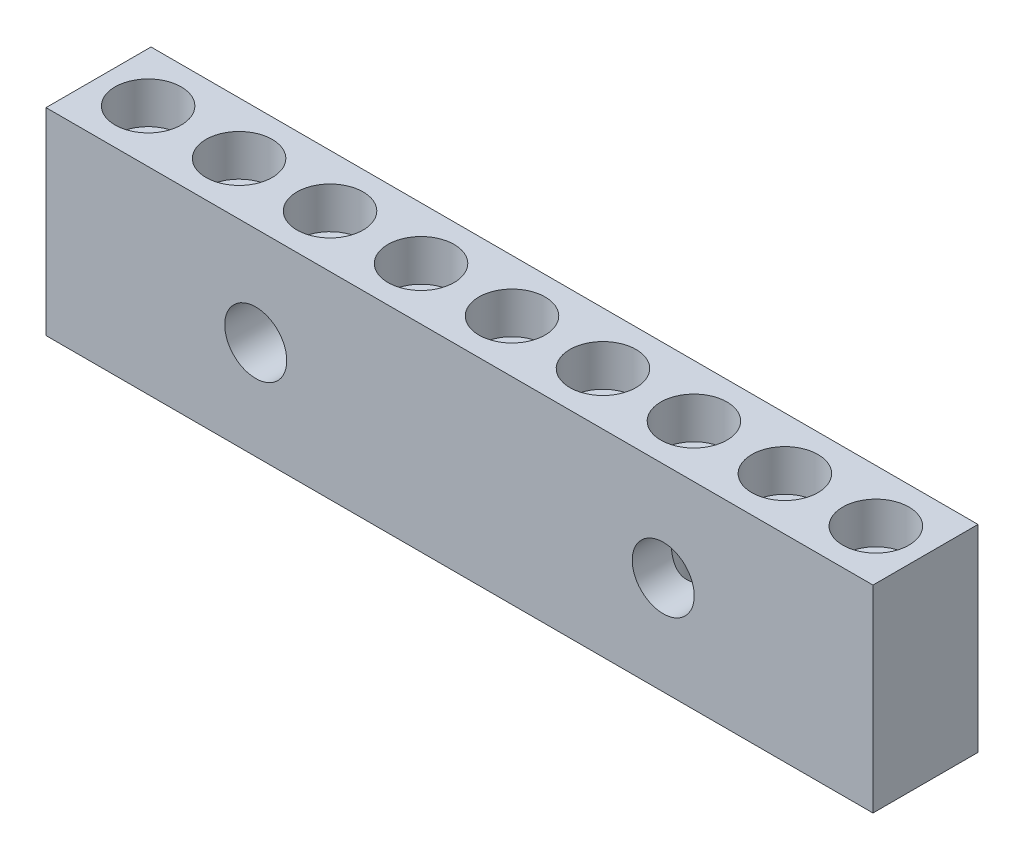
SolidWorks part; units mm, degrees
ref_plane "Front Plane" through (0, 0, 0) normal (0, 0, 1) x (1, 0, 0)
ref_plane "Top Plane" through (0, 0, 0) normal (0, 1, 0) x (1, 0, 0)
ref_plane "Right Plane" through (0, 0, 0) normal (1, 0, 0) x (0, 0, -1)
sketch "Sketch1" plane through (0, 0, 0) normal (0, 0, 1) x (1, 0, 0)
  line L1 (100, -23.875) -> (-100, -23.875)
  line L2 (100, -23.875) -> (100, 23.875)
  line L3 (100, 23.875) -> (-100, 23.875)
  line L4 (-100, -23.875) -> (-100, 23.875)
  line L5 (100, -23.875) -> (-100, 23.875) construction
  line L6 (100, 23.875) -> (-100, -23.875) construction
  point P0 (0, 0)
  dimension "D1" = 200
  dimension "D2" = 47.75
extrude "Boss-Extrude1" add sketch "Sketch1" along normal mid plane 25.4
sketch "Sketch2" plane through (0, 0, 0) normal (0, 0, 1) x (1, 0, 0)
  line L0 (0, 32.0168) -> (0, -37.0588) construction
sketch "Sketch3" plane through (0, 0, 12.7) normal (0, 0, 1) x (1, 0, 0)
  line L0 (-100, 23.875) -> (-100, -23.875) construction
  line L1 (-100, -23.875) -> (100, -23.875) construction
  circle A0 centre (-49.275, -0.005) radius 7.5
  circle A1 centre (49.275, -0.005) radius 7.5
  point P9 (-49.275, -0.005)
  point P10 (49.275, -0.005)
  dimension "D4" = 15
  dimension "D1" = 98.55
  dimension "D2" = 50.725
  dimension "D3" = 23.87
extrude "Cut-Extrude1" cut sketch "Sketch3" against normal up to surface (25.4 mm away)
sketch "Sketch4" plane through (0, 0, 12.7) normal (0, 0, 1) x (1, 0, 0)
  line L0 (-100, 23.875) -> (-100, -23.875) construction
  line L1 (-100, -23.875) -> (100, -23.875) construction
  circle A0 centre (-74.275, -0.005) radius 9
  circle A1 centre (24.275, -0.005) radius 9
  point P9 (24.275, -0.005)
  point P10 (-74.275, -0.005)
  dimension "D1" = 18
  dimension "D2" = 98.55
  dimension "D3" = 25.725
  dimension "D4" = 23.87
extrude "Cut-Extrude2" [suppressed] cut sketch "Sketch4" against normal blind 5
sketch "Sketch5" [suppressed] plane through (0, 0, 7.7) normal (0, 0, 1) x (1, 0, 0)
  circle A0 centre (-49.275, -0.005) radius 6
  circle A1 centre (49.275, -0.005) radius 6
  dimension "D1" = 12
extrude "Cut-Extrude3" [suppressed] cut sketch "Sketch5" against normal up to surface (20.4 mm away)
sketch "Sketch6" plane through (0, 23.875, 0) normal (0, 1, 0) x (1, 0, 0)
  line L0 (-100, -12.7) -> (-100, 12.7) construction
  circle A0 centre (-88, 0) radius 8
  point P2 (0, 0)
  point P6 (-88, 0)
  dimension "D1" = 16
  dimension "D2" = 12
extrude "Cut-Extrude4" cut sketch "Sketch6" against normal blind 10
sketch "Sketch7" plane through (0, 13.875, 0) normal (0, 1, 0) x (1, 0, 0)
  circle A0 centre (-88, 0) radius 4
  dimension "D1" = 8
extrude "Cut-Extrude5" cut sketch "Sketch7" against normal up to surface (37.75 mm away)
pattern_linear "LPattern1" count 9 spacing 22 along (1, 0, 0) of "Cut-Extrude4", "Cut-Extrude5"
